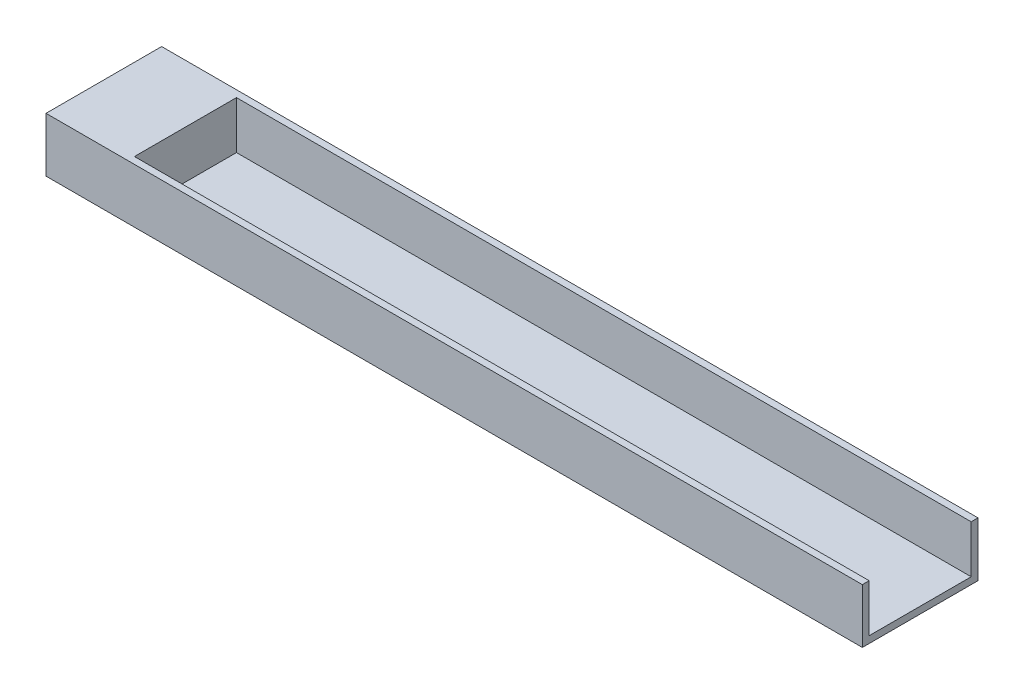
SolidWorks part; units mm, degrees
ref_plane "Front Plane" through (0, 0, 0) normal (0, 0, 1) x (1, 0, 0)
ref_plane "Top Plane" through (0, 0, 0) normal (0, 1, 0) x (1, 0, 0)
ref_plane "Right Plane" through (0, 0, 0) normal (1, 0, 0) x (0, 0, -1)
sketch "Sketch7" plane through (0, 0, 0) normal (0, 1, 0) x (1, 0, 0)
  line L1 (0, 0) -> (762, 0)
  line L2 (0, 0) -> (0, 107.95)
  line L3 (0, 107.95) -> (762, 107.95)
  line L4 (762, 0) -> (762, 107.95)
  dimension "D1" = 107.95
  dimension "D2" = 762
extrude "Boss-Extrude2" add sketch "Sketch7" along normal blind 50.8
sketch "Sketch8" plane through (762, 0, 0) normal (1, 0, 0) x (0, 0, -1)
  line L0 (0, 50.8) -> (107.95, 50.8) construction
  line L1 (6.35, 50.8) -> (101.6, 50.8)
  line L2 (6.35, 50.8) -> (6.35, 6.35)
  line L3 (6.35, 6.35) -> (101.6, 6.35)
  line L4 (101.6, 50.8) -> (101.6, 6.35)
  line L5 (0, 50.8) -> (0, 0) construction
  line L6 (107.95, 50.8) -> (107.95, 0) construction
  line L7 (0, 0) -> (107.95, 0) construction
  dimension "D1" = 6.35
  dimension "D2" = 6.35
  dimension "D3" = 6.35
extrude "Cut-Extrude1" cut sketch "Sketch8" against normal blind 685.8
